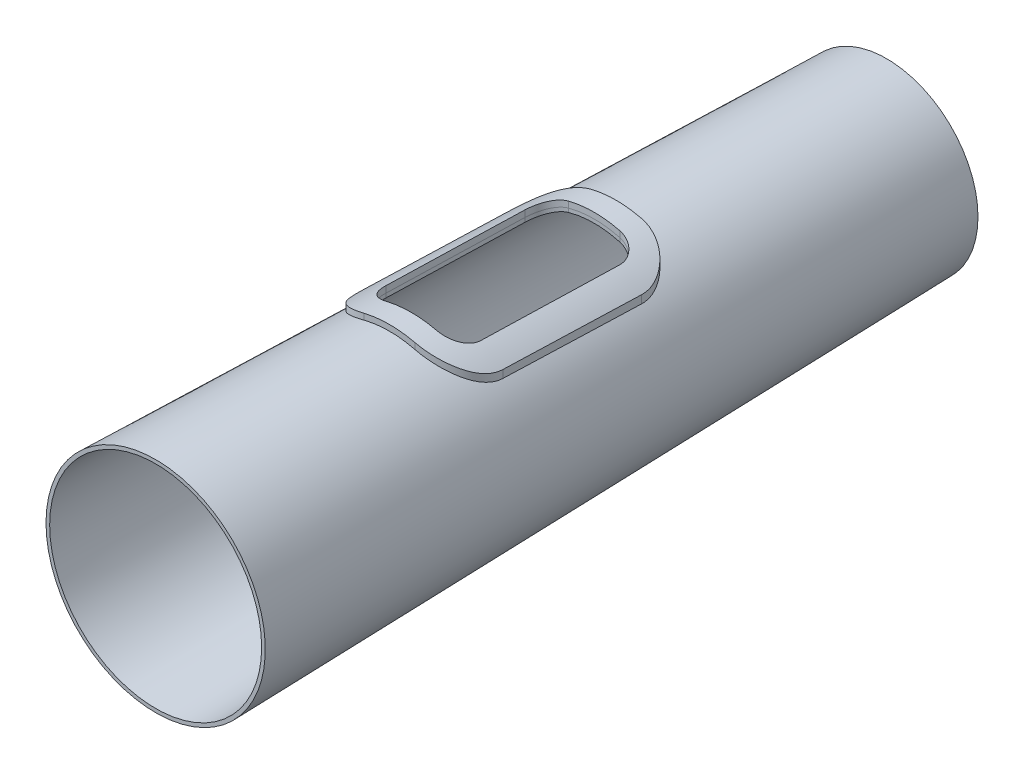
SolidWorks part; units mm, degrees
ref_plane "Vorne" through (0, 0, 0) normal (0, 0, 1) x (1, 0, 0)
ref_plane "Oben" through (0, 0, 0) normal (0, 1, 0) x (1, 0, 0)
ref_plane "Rechts" through (0, 0, 0) normal (1, 0, 0) x (0, 0, -1)
sketch "Skizze1" plane through (0, 0, 0) normal (1, 0, 0) x (0, 0, -1)
  line L0 (0, 0) -> (1000, 0)
  line L1 (1000, 0) -> (1000, 125)
  line L2 (1000, 125) -> (0, 150)
  line L3 (0, 150) -> (0, 0)
  line L4 (0, 0) -> (-32.0434, 0) construction
  dimension "D1" = 1000
  dimension "D2" = 150
  dimension "D3" = 125
revolve "Rotation1" add sketch "Skizze1"
other "Der Ursprungskörper" parameters "D1"=360
shell "Wandung1" thickness 5
sketch "Skizze2" plane through (0, 0, 0) normal (0, 1, 0) x (1, 0, 0)
  line L0 (-150, 0) -> (150, 0) construction
  line L1 (-35, 600) -> (35, 600)
  line L2 (-65, 570) -> (-65, 380)
  line L3 (-35, 350) -> (35, 350)
  line L4 (65, 570) -> (65, 380)
  arc A0 (-35, 600) -> (-65, 570) centre (-35, 570) ccw
  arc A1 (65, 570) -> (35, 600) centre (35, 570) ccw
  arc A2 (35, 350) -> (65, 380) centre (35, 380) ccw
  arc A3 (-65, 380) -> (-35, 350) centre (-35, 380) ccw
  point P4 (0, 350)
  point P12 (65, 600)
  point P15 (65, 350)
  point P18 (-65, 350)
  dimension "D4" = 30
  dimension "D1" = 130
  dimension "D2" = 250
  dimension "D3" = 350
extrude "Linear austragen1" cut sketch "Skizze2" along normal through all
surface "Oberfläche-Offset8" parameters "D1"=30
surface "Oberfläche-Verlängern8" parameters "D1"=20, "D2"=20, "D3"=20, "D4"=20, "D5"=20, "D6"=20, "D7"=20, "D8"=20
surface "Oberfläche-Offset9" parameters "D1"=0
surface "Oberfläche-Verlängern9" parameters "D1"=32.57, "D2"=32.57, "D3"=32.57, "D4"=32.57, "D5"=32.57, "D6"=32.57, "D7"=32.57, "D8"=32.57
surface "Oberfläche-Offset10" parameters "D1"=0
surface "Oberfläche-Offset11" parameters "D1"=8
surface "Oberfläche-Verlängern10" parameters "D1"=10
surface "Oberfläche-Trimmen9"
